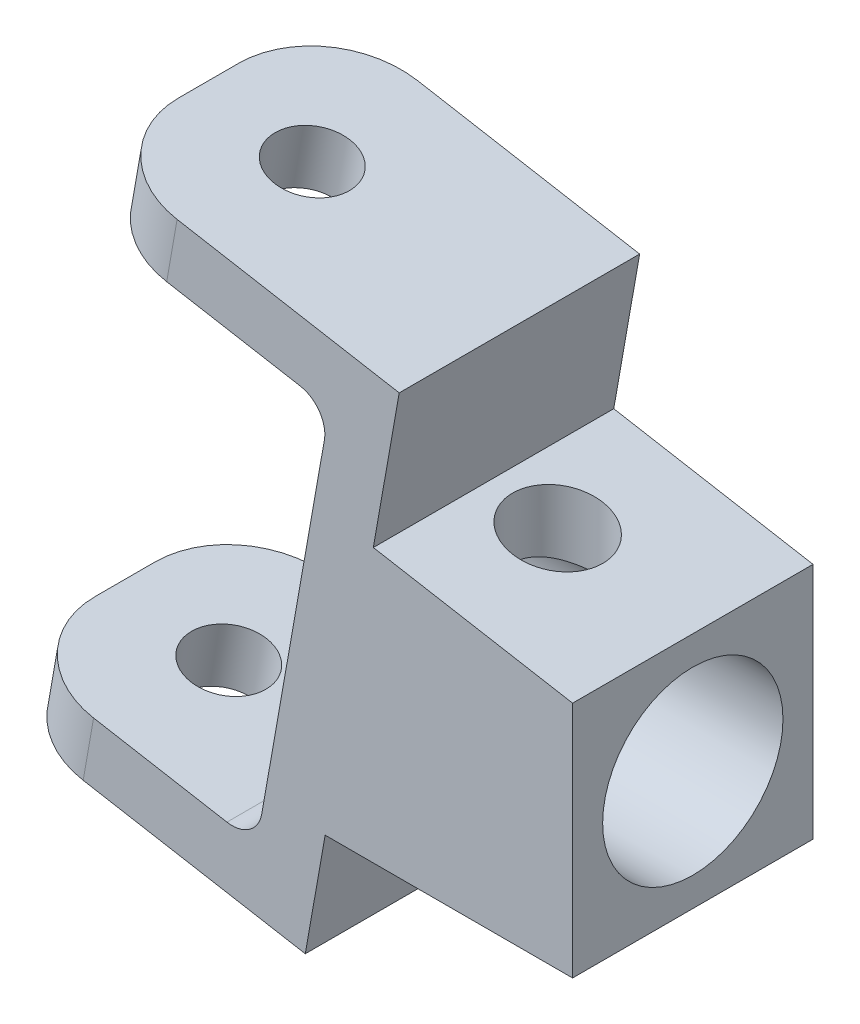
SolidWorks part; units mm, degrees
ref_plane "Front Plane" through (0, 0, 0) normal (0, 0, 1) x (1, 0, 0)
ref_plane "Top Plane" through (0, 0, 0) normal (0, 1, 0) x (1, 0, 0)
ref_plane "Right Plane" through (0, 0, 0) normal (1, 0, 0) x (0, 0, -1)
sketch "Sketch1" plane through (0, 0, 0) normal (0, 0, 1) x (1, 0, 0)
  line L0 (0, 0) -> (87.2031, 0) construction
  line L1 (0, 0) -> (0, 43.9384) construction
  line L2 (-43.6075, -18.6861) -> (-10.764, -24.4773)
  line L3 (17.4752, -24.4773) -> (17.4752, 28.575)
  line L4 (17.4752, 28.575) -> (-33.6835, 37.5957)
  line L5 (-33.6835, 37.5957) -> (-34.7862, 31.3421)
  line L6 (-34.7862, 31.3421) -> (-8.1962, 26.6536)
  line L7 (-8.1962, 26.6536) -> (-15.9148, -17.1211)
  line L8 (-15.9148, -17.1211) -> (-42.5048, -12.4326)
  line L9 (-42.5048, -12.4326) -> (-43.6075, -18.6861)
  line L10 (-14.5754, -9.525) -> (77.2982, -9.525) construction
  line L11 (-11.2164, 9.525) -> (75.5733, 9.525) construction
  line L12 (17.4752, -24.4773) -> (-10.764, -24.4773)
  line L13 (-0.84, 31.8045) -> (-3.5765, 16.285)
  line L14 (-3.5765, 16.285) -> (17.4752, 12.573)
  line L15 (-32.6513, -20.618) -> (-31.5487, -14.3644)
  line L16 (-23.83, 29.4103) -> (-22.7273, 35.6638)
  line L17 (-10.764, -24.4773) -> (-8.6649, -12.573)
  line L18 (-8.6649, -12.573) -> (17.4752, -12.573)
  line L19 (3.2004, 0) -> (3.2004, 9.525) construction
  dimension "D1" = 10
  dimension "D2" = 6.35
  dimension "D3" = 6.35
  dimension "D4" = 28.575
  dimension "D5" = 44.45
  dimension "D6" = 17.4752
  dimension "D7" = 12.7
  dimension "D8" = 27.0002
  dimension "D9" = 19.05
  dimension "D11" = 6.35
  dimension "D12" = 32.0506
  dimension "D13" = 28.6916
  dimension "D14" = 62.073
  dimension "D15" = 61.0827
  dimension "D16" = 11.1252
  dimension "D17" = 3.048
  dimension "D18" = 15.875
  dimension "D19" = 3.048
  dimension "D20" = 14.2748
sketch "Sketch2" plane through (0, 0, 0) normal (0, 0, 1) x (1, 0, 0)
  line L0 (-43.6075, -18.6861) -> (-10.764, -24.4773) construction
  line L2 (17.4752, -24.4773) -> (17.4752, 28.575) construction
  line L3 (17.4752, 28.575) -> (-33.6835, 37.5957) construction
  line L4 (-33.6835, 37.5957) -> (-34.7862, 31.3421) construction
  line L5 (-34.7862, 31.3421) -> (-8.1962, 26.6536) construction
  line L6 (-8.1962, 26.6536) -> (-15.9148, -17.1211) construction
  line L7 (-15.9148, -17.1211) -> (-42.5048, -12.4326) construction
  line L8 (-42.5048, -12.4326) -> (-43.6075, -18.6861) construction
  line L9 (-43.6075, -18.6861) -> (-10.764, -24.4773)
  line L11 (17.4752, -12.573) -> (17.4752, 12.573)
  line L12 (-0.84, 31.8045) -> (-33.6835, 37.5957)
  line L13 (-33.6835, 37.5957) -> (-34.7862, 31.3421)
  line L14 (-34.7862, 31.3421) -> (-8.1962, 26.6536)
  line L15 (-8.1962, 26.6536) -> (-15.9148, -17.1211)
  line L16 (-15.9148, -17.1211) -> (-42.5048, -12.4326)
  line L17 (-42.5048, -12.4326) -> (-43.6075, -18.6861)
  line L18 (-0.84, 31.8045) -> (-3.5765, 16.285) construction
  line L19 (-3.5765, 16.285) -> (17.4752, 12.573) construction
  line L20 (-10.764, -24.4773) -> (-8.6649, -12.573) construction
  line L21 (-8.6649, -12.573) -> (17.4752, -12.573) construction
  line L22 (-0.84, 31.8045) -> (-3.5765, 16.285)
  line L23 (-3.5765, 16.285) -> (17.4752, 12.573)
  line L24 (-10.764, -24.4773) -> (-8.6649, -12.573)
  line L25 (-8.6649, -12.573) -> (17.4752, -12.573)
extrude "Boss-Extrude1" add sketch "Sketch2" along normal mid plane 25.4
sketch "Sketch3" plane through (0, 0, 0) normal (1, 0, 0) x (0, 0, -1)
  circle A0 centre (0, 0) radius 9.525
  dimension "D1" = 19.05
extrude "Cut-Extrude1" cut sketch "Sketch3" against normal mid plane 46.99
sketch "Sketch7" plane through (5.4136, 30.7018, 0) normal (0.1736, 0.9848, 0) x (0.9848, -0.1736, 0)
  circle A0 centre (-28.575, 0) radius 3.9878
  dimension "D1" = 7.9756
extrude "Cut-Extrude4" cut sketch "Sketch7" against normal blind 67.31
fillet "Fillet1" radius 9.525 4 edges at (-43.0562, -15.5593, 12.7) (-43.0562, -15.5593, -12.7) (-34.2348, 34.4689, -12.7) (-34.2348, 34.4689, 12.7)
fillet "Fillet3" radius 3.175 2 edges at (-15.9148, -17.1211, 0) (-8.1962, 26.6536, 0)
fillet "Fillet4" [suppressed] radius 6.35
sketch "Sketch8" plane through (0, 0, 0) normal (0, 1, 0) x (1, 0, 0)
  circle A0 centre (3.2004, 0) radius 3.175
  circle A1 centre (3.2004, 0) radius 4.7625
  dimension "D1" = 6.35
  dimension "D2" = 9.525
sketch "Sketch9" plane through (0, 0, 0) normal (0, 1, 0) x (1, 0, 0)
  circle A0 centre (3.2004, 0) radius 4.7625 construction
  circle A1 centre (3.2004, 0) radius 4.7625
extrude "Cut-Extrude5" cut sketch "Sketch9" along normal blind 25.4
sketch "Sketch10" plane through (0, 0, 0) normal (0, 1, 0) x (1, 0, 0)
  circle A0 centre (3.2004, 0) radius 3.175 construction
  circle A1 centre (3.2004, 0) radius 3.175
extrude "Cut-Extrude6" cut sketch "Sketch10" against normal blind 22.86
fillet "Fillet5" [suppressed] radius 6.35
fillet "Fillet6" [suppressed] radius 1.5748
